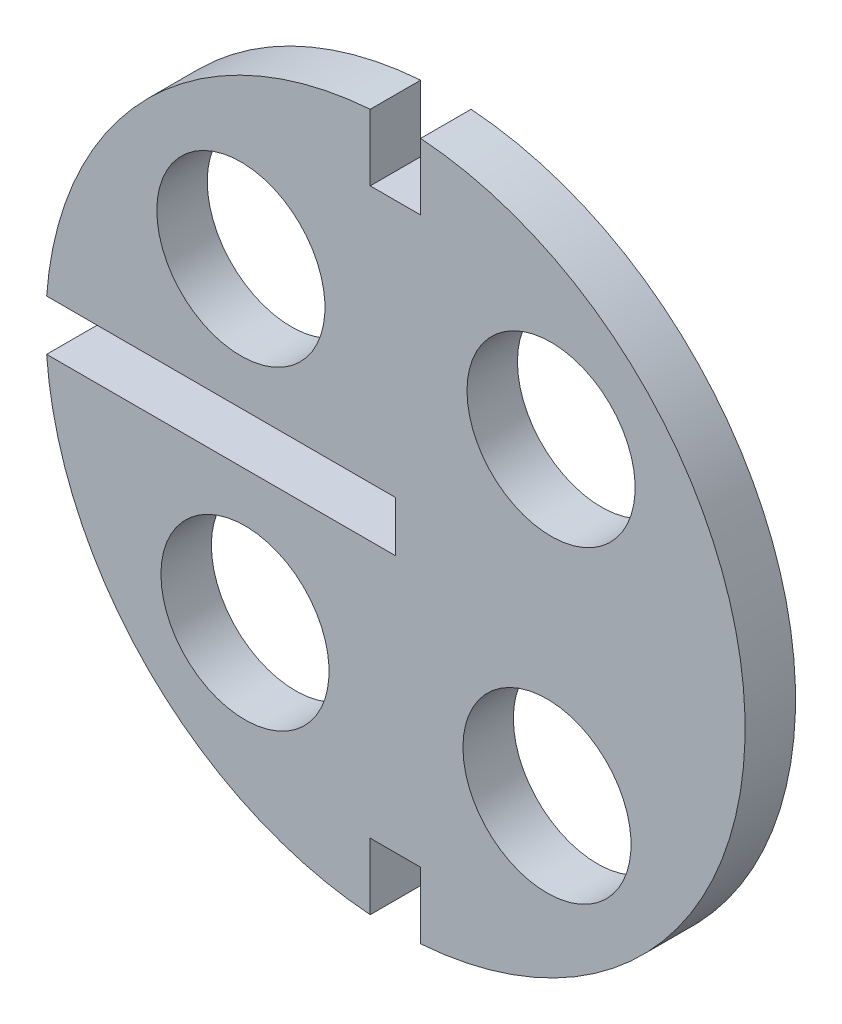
SolidWorks part; units mm, degrees
ref_plane "Front Plane" through (0, 0, 0) normal (0, 0, 1) x (1, 0, 0)
ref_plane "Top Plane" through (0, 0, 0) normal (0, 1, 0) x (1, 0, 0)
ref_plane "Right Plane" through (0, 0, 0) normal (1, 0, 0) x (0, 0, -1)
sketch "Sketch1" plane through (0, 0, 0) normal (0, 0, 1) x (1, 0, 0)
  circle A0 centre (0, 0) radius 26.416
  dimension "D1" = 52.832
extrude "Extrude1" add sketch "Sketch1" along normal blind 3.81
sketch "Sketch2" plane through (0, 0, 0) normal (0, 0, 1) x (1, 0, 0)
  line L0 (0, 0) -> (0, 27.8395) construction
  line L1 (0, 0) -> (0, -28.8472) construction
  line L2 (0, 0) -> (-23.3487, 23.3487) construction
  line L3 (0, 0) -> (-29.645, 0) construction
  line L4 (0, 0) -> (31.2407, 0) construction
  circle A0 centre (-11.6743, 11.6743) radius 6.35
  circle A1 centre (11.7569, 11.5912) radius 6.35
  circle A2 centre (11.4489, -11.8955) radius 6.35
  circle A3 centre (-11.3643, -11.9764) radius 6.35
  dimension "D2" = 12.7
  dimension "D4" = 12.7
  dimension "D5" = 12.7
  dimension "D6" = 12.7
  dimension "D1" = 45
  dimension "D3" = 16.51
  dimension "D7" = 16.51
  dimension "D8" = 16.51
  dimension "D9" = 16.51
extrude "Cut-Extrude1" cut sketch "Sketch2" along normal through all
sketch "Sketch3" plane through (0, 0, 0) normal (0, 0, 1) x (1, 0, 0)
  line L0 (0, 0) -> (0, 27.4196) construction
  line L1 (0, 0) -> (0, -27.9234) construction
  line L2 (-30.4848, 0) -> (29.645, 0) construction
  line L4 (-1.905, 27.4196) -> (1.905, 27.4196)
  line L5 (-1.905, 27.4196) -> (-1.905, 21.336)
  line L6 (-1.905, 21.336) -> (1.905, 21.336)
  line L7 (1.905, 27.4196) -> (1.905, 21.336)
  line L8 (1.905, -27.9234) -> (-1.905, -27.9234)
  line L9 (1.905, -27.9234) -> (1.905, -21.336)
  line L10 (1.905, -21.336) -> (-1.905, -21.336)
  line L11 (-1.905, -27.9234) -> (-1.905, -21.336)
  line L12 (-28.3014, 1.905) -> (0, 1.905)
  line L13 (-28.3014, 1.905) -> (-28.3014, -1.905)
  line L14 (-28.3014, -1.905) -> (0, -1.905)
  line L15 (0, 1.905) -> (0, -1.905)
  dimension "D1" = 3.81
  dimension "D2" = 3.81
  dimension "D3" = 1.905
  dimension "D4" = 1.905
  dimension "D5" = 21.336
  dimension "D6" = 21.336
  dimension "D7" = 3.81
  dimension "D8" = 1.905
extrude "Cut-Extrude2" cut sketch "Sketch3" along normal through all
